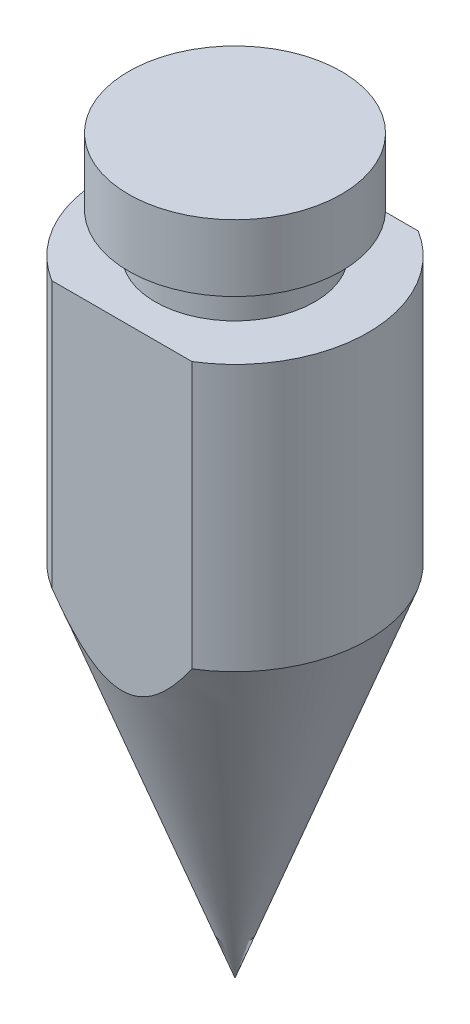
SolidWorks part; units mm, degrees
ref_plane "前视基准面" through (0, 0, 0) normal (0, 0, 1) x (1, 0, 0)
ref_plane "上视基准面" through (0, 0, 0) normal (0, 1, 0) x (1, 0, 0)
ref_plane "右视基准面" through (0, 0, 0) normal (1, 0, 0) x (0, 0, -1)
sketch "草图1" plane through (0, 0, 0) normal (0, 0, 1) x (1, 0, 0)
  line L0 (0, 0) -> (0, -27)
  line L2 (0, 0) -> (0, 28)
  line L3 (-6, 20) -> (-10, 20)
  line L4 (-10, 0) -> (-10, 20)
  line L5 (0, -27) -> (-10, 0)
  line L7 (-8, 28) -> (0, 28)
  line L8 (-8, 28) -> (-8, 23)
  line L9 (-8, 23) -> (-6, 23)
  line L10 (-6, 23) -> (-6, 20)
  dimension "D1" = 20
  dimension "D2" = 8
  dimension "D3" = 10
  dimension "D4" = 55
  dimension "D5" = 8
  dimension "D6" = 6
  dimension "D7" = 3
revolve "旋转1" add sketch "草图1" angle 360 about L2
sketch "草图2" plane through (0, 20, 0) normal (0, 1, 0) x (1, 0, 0)
  line L0 (-5.2678, 8.5) -> (-5.2678, 18.5)
  line L1 (-5.2678, -8.5) -> (5.2678, -8.5)
  line L2 (-5.2678, -8.5) -> (-5.2678, 8.5) construction
  line L3 (-5.2678, 8.5) -> (5.2678, 8.5)
  line L4 (5.2678, -8.5) -> (5.2678, 8.5) construction
  line L5 (-5.2678, -8.5) -> (5.2678, 8.5) construction
  line L6 (-5.2678, 8.5) -> (5.2678, -8.5) construction
  line L7 (5.2678, -18.5) -> (-5.2678, -18.5)
  line L8 (5.2678, -18.5) -> (5.2678, -8.5)
  line L9 (5.2678, 18.5) -> (-5.2678, 18.5)
  line L10 (-5.2678, -18.5) -> (-5.2678, -8.5)
  line L11 (5.2678, -18.5) -> (-5.2678, 18.5) construction
  line L12 (5.2678, 18.5) -> (-5.2678, -18.5) construction
  line L13 (5.2678, 8.5) -> (5.2678, 18.5)
  circle A0 centre (0, 0) radius 10 construction
  point P0 (0, 0)
  point P8 (0, 0)
  dimension "D1" = 8.5
  dimension "D2" = 10
extrude "切除-拉伸1" cut sketch "草图2" against normal through all
